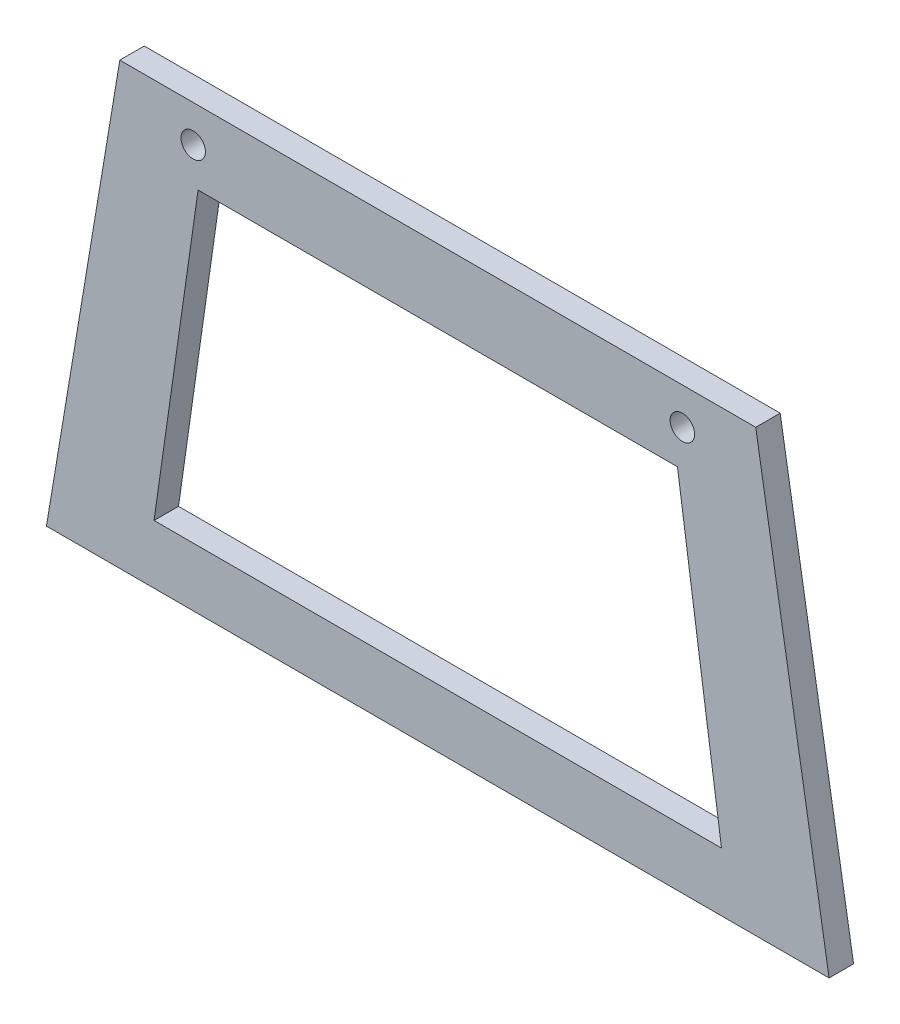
SolidWorks part; units mm, degrees
ref_plane "Front Plane" through (0, 0, 0) normal (0, 0, 1) x (1, 0, 0)
ref_plane "Top Plane" through (0, 0, 0) normal (0, 1, 0) x (1, 0, 0)
ref_plane "Right Plane" through (0, 0, 0) normal (1, 0, 0) x (0, 0, -1)
sketch "Sketch1" plane through (0, 0, 0) normal (0, 0, 1) x (1, 0, 0)
  line L0 (-101.6, 0) -> (101.6, 0)
  line L1 (101.6, 0) -> (82.55, 114.3)
  line L2 (82.55, 114.3) -> (-82.55, 114.3)
  line L3 (-82.55, 114.3) -> (-101.6, 0)
extrude "Boss-Extrude1" add sketch "Sketch1" along normal mid plane 6.35
sketch "Sketch2" plane through (0, 0, 0) normal (0, 0, 1) x (1, 0, 0)
  line L0 (-73.66, 15.24) -> (73.66, 15.24)
  line L1 (73.66, 15.24) -> (62.23, 95.25)
  line L2 (62.23, 95.25) -> (-62.23, 95.25)
  line L3 (-62.23, 95.25) -> (-73.66, 15.24)
  circle A0 centre (-63.5, 104.775) radius 3.175
  circle A1 centre (63.5, 104.775) radius 3.175
extrude "Cut-Extrude1" cut sketch "Sketch2" against normal mid plane 25.4
